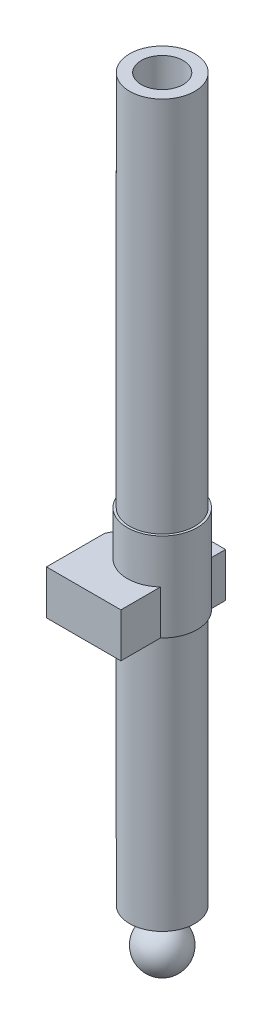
SolidWorks part; units mm, degrees
ref_plane "Plan de face" through (0, 0, 0) normal (0, 0, 1) x (1, 0, 0)
ref_plane "Plan de dessus" through (0, 0, 0) normal (0, 1, 0) x (1, 0, 0)
ref_plane "Plan de droite" through (0, 0, 0) normal (1, 0, 0) x (0, 0, -1)
sketch "Esquisse1" plane through (0, 0, 0) normal (0, 1, 0) x (1, 0, 0)
  line L0 (0, 15.7652) -> (0, -22.6524) construction
  line L1 (0, -10) -> (0, 10)
  arc A0 (0, -10) -> (0, 10) centre (0, 0) ccw
  dimension "D1" = 10
revolve "Révolution3" add sketch "Esquisse1" angle 360 about L0
sketch "Esquisse2" plane through (0, 0, 0) normal (0, 1, 0) x (1, 0, 0)
  circle A0 centre (0, 0) radius 3
  dimension "D1" = 6
extrude "Boss.-Extru.1" add sketch "Esquisse2" along normal blind 15
sketch "Esquisse3" plane through (0, 15, 0) normal (0, 1, 0) x (1, 0, 0)
  circle A0 centre (0, 0) radius 14
  dimension "D1" = 28
extrude "Boss.-Extru.2" add sketch "Esquisse3" along normal blind 310
sketch "Esquisse4" plane through (0, 325, 0) normal (0, 1, 0) x (1, 0, 0)
  circle A0 centre (0, 0) radius 9
  dimension "D1" = 18
extrude "Enlèv. mat.-Extru.1" cut sketch "Esquisse4" against normal blind 220
fillet "Congé1" radius 4 1 edges at (0, 15, 3)
fillet "Congé2" radius 4 1 edges at (0, 9.5394, -3)
ref_plane "Plan1" through (0, 125, 0) normal (0, -1, 0) x (1, 0, 0)
sketch "Esquisse5" plane through (0, 125, 0) normal (0, -1, 0) x (1, 0, 0)
  circle A0 centre (0, 0) radius 15
  dimension "D1" = 30
extrude "Boss.-Extru.3" add sketch "Esquisse5" against normal blind 38
ref_plane "Plan2" through (0, 0, 28) normal (0, 0, 1) x (1, 0, 0)
sketch "Esquisse6" plane through (0, 0, 28) normal (0, 0, 1) x (1, 0, 0)
  line L0 (-15.4, 125) -> (15.4, 125) construction
  line L1 (-21.7773, 125) -> (10.2227, 125)
  line L2 (-21.7773, 125) -> (-21.7773, 144)
  line L3 (-21.7773, 144) -> (10.2227, 144)
  line L4 (10.2227, 125) -> (10.2227, 144)
  dimension "D1" = 19
  dimension "D2" = 32
extrude "Boss.-Extru.4" add sketch "Esquisse6" against normal blind 45
chamfer "Chanfrein1" distance 10 distance2 20 1 edges at (-21.7773, 134.5, -17)
